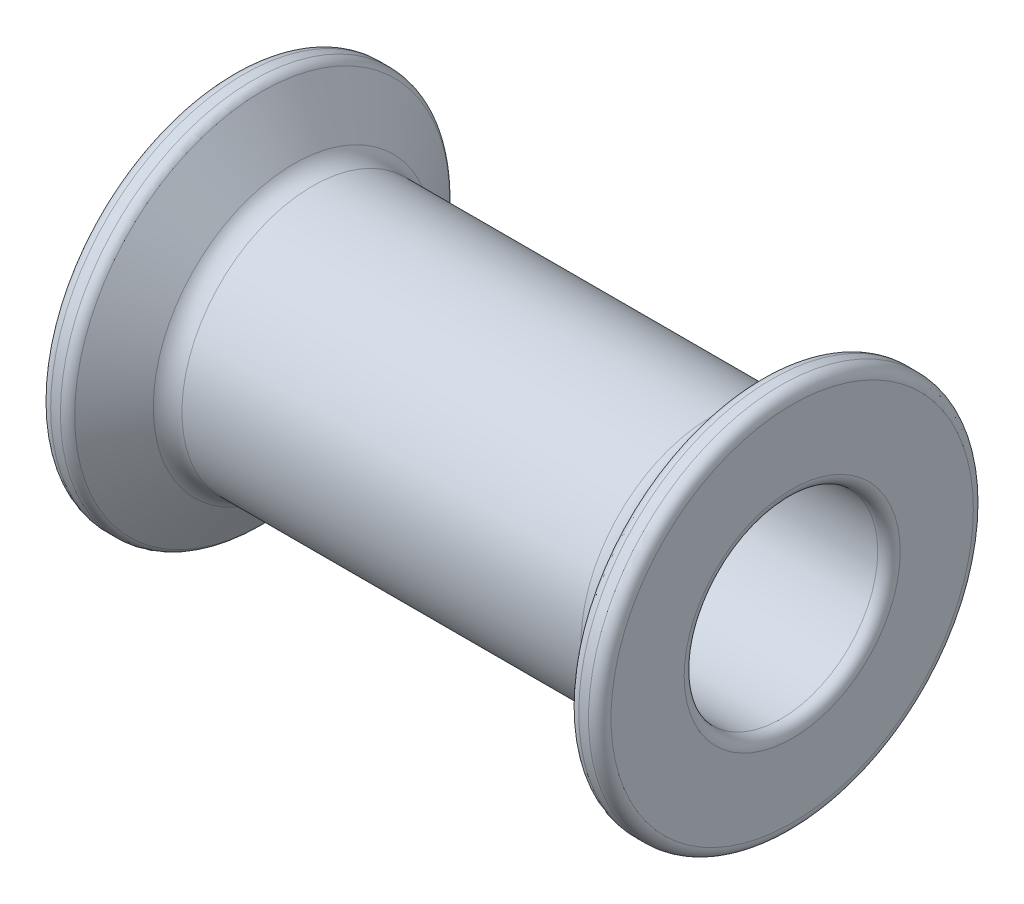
SolidWorks part; units mm, degrees
ref_plane "Front" through (0, 0, 0) normal (0, 0, 1) x (1, 0, 0)
ref_plane "Top" through (0, 0, 0) normal (0, 1, 0) x (1, 0, 0)
ref_plane "Right" through (0, 0, 0) normal (1, 0, 0) x (0, 0, -1)
sketch "Sketch1" plane through (0, 0, 0) normal (0, 0, 1) x (1, 0, 0)
  line L0 (0, 0) -> (-11.9, 0) construction
  line L1 (0, 5.8) -> (-9.4, 5.8)
  line L2 (-9.4, 5.8) -> (-11.25, 8.55)
  line L3 (-11.25, 8.55) -> (-12.45, 8.55)
  line L4 (-12.45, 8.55) -> (-12.45, 4.3)
  line L5 (-12.45, 4.3) -> (0, 4.3)
  line L6 (0, 4.3) -> (0, 5.8)
  dimension "D1" = 12.45
  dimension "D2" = 11.6
  dimension "D3" = 1.5
  dimension "D4" = 9.4
  dimension "D5" = 1.2
  dimension "D6" = 17.1
revolve "Revolve1" add sketch "Sketch1" angle 360 about L0
mirror "Mirror1" about plane through (0, 4.3, 0) normal (1, 0, 0) of "Revolve1"
fillet "Fillet1" radius 1 2 edges at (-9.4, 0, -5.8) (9.4, 0, -5.8)
fillet "Fillet2" radius 0.5 6 edges at (11.25, 0, -8.55) (12.45, 0, -8.55) (12.45, 0, -4.3) (-12.45, 0, -4.3) (-12.45, 0, -8.55) (-11.25, 0, -8.55)
